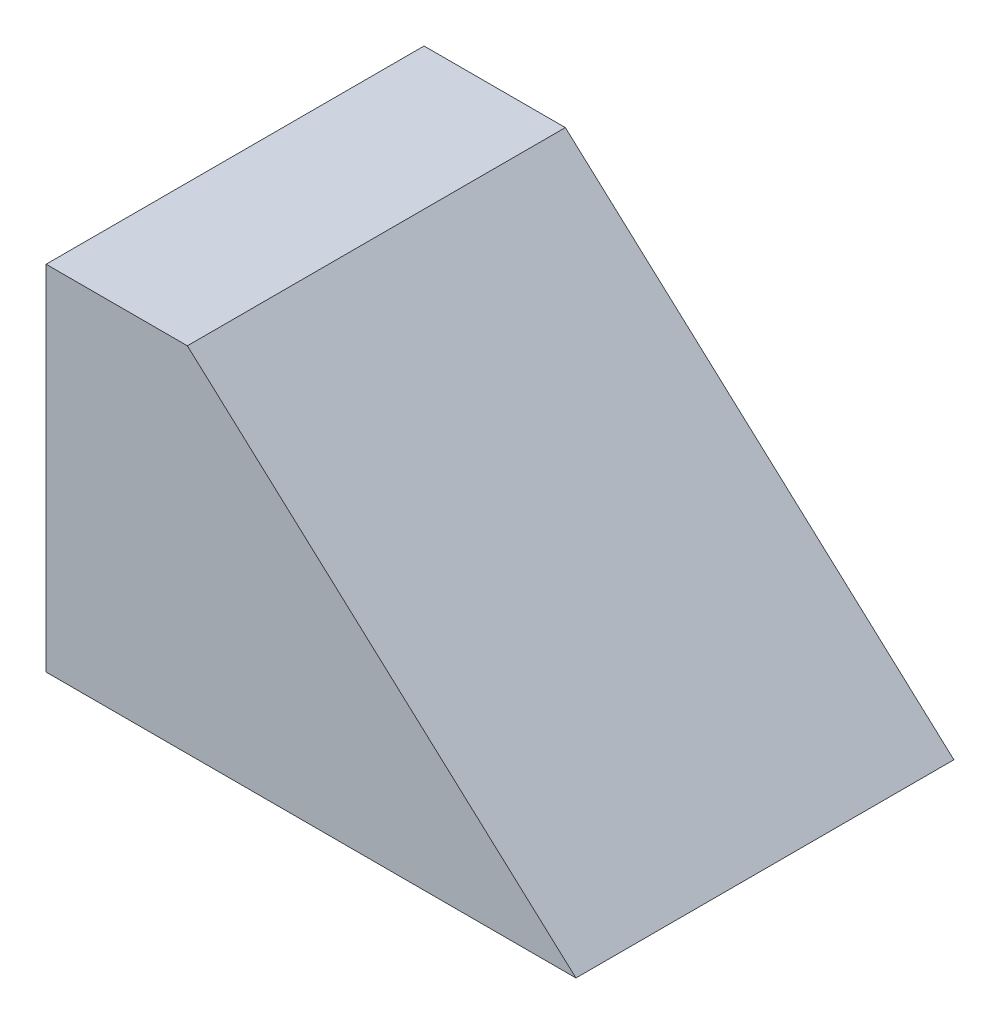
SolidWorks part; units mm, degrees
ref_plane "Front Plane" through (0, 0, 0) normal (0, 0, 1) x (1, 0, 0)
ref_plane "Top Plane" through (0, 0, 0) normal (0, 1, 0) x (1, 0, 0)
ref_plane "Right Plane" through (0, 0, 0) normal (1, 0, 0) x (0, 0, -1)
sketch "Sketch1" plane through (0, 0, 0) normal (0, 0, 1) x (1, 0, 0)
  line L0 (40, 100) -> (150, 0)
  line L1 (0, 0) -> (150, 0)
  line L2 (0, 0) -> (0, 100)
  line L3 (0, 100) -> (40, 100)
  dimension "D1" = 150
  dimension "D2" = 100
  dimension "D3" = 40
extrude "Boss-Extrude1" add sketch "Sketch1" along normal blind 107
